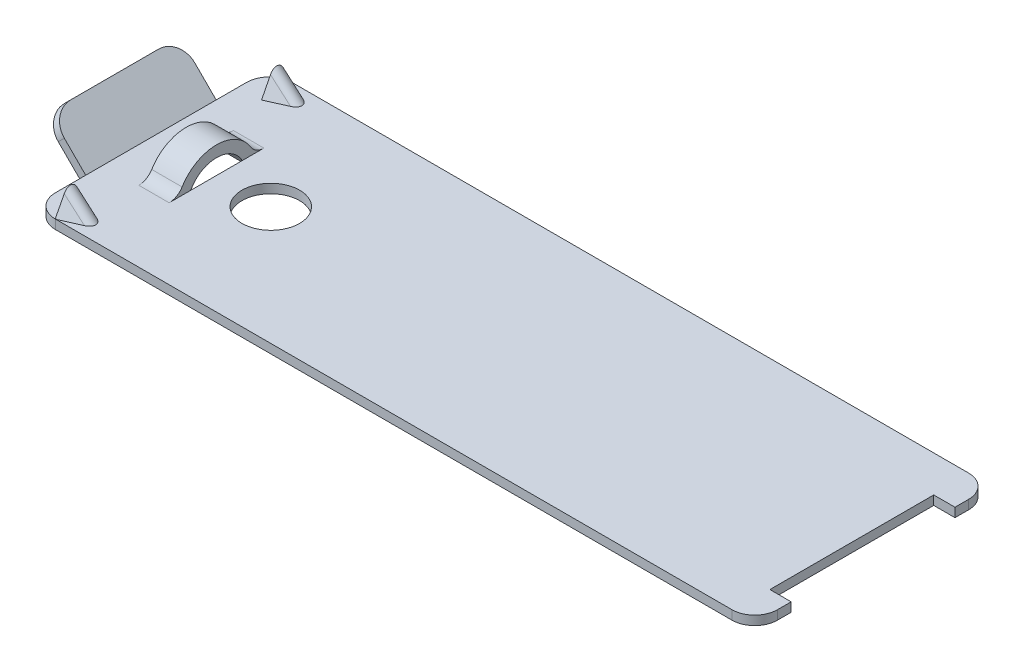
SolidWorks part; units mm, degrees
ref_plane "Front Plane" through (0, 0, 0) normal (0, 0, 1) x (1, 0, 0)
ref_plane "Top Plane" through (0, 0, 0) normal (0, 1, 0) x (1, 0, 0)
ref_plane "Right Plane" through (0, 0, 0) normal (1, 0, 0) x (0, 0, -1)
imported_body "FLOOR PLATE"
sketch "Sketch1" plane through (0, 0, 0) normal (0, -1, 0) x (1, 0, 0)
  line L0 (-27.3685, -3.7782) -> (17.0749, -3.7782)
  line L1 (17.0749, -3.7782) -> (17.0749, 3.4799)
  line L2 (17.0749, 3.4799) -> (-27.3685, 2.6541)
  line L3 (-27.3685, 2.6541) -> (-27.3685, 1.8703)
  line L4 (-27.3685, 1.8703) -> (-27.0096, 1.2657)
  line L5 (-27.0096, 1.2657) -> (-27.0096, -2.6756)
  line L6 (-27.0096, -2.6756) -> (-27.3685, -3.7782)
extrude "Boss-Extrude1" add sketch "Sketch1" against normal blind 0.762
